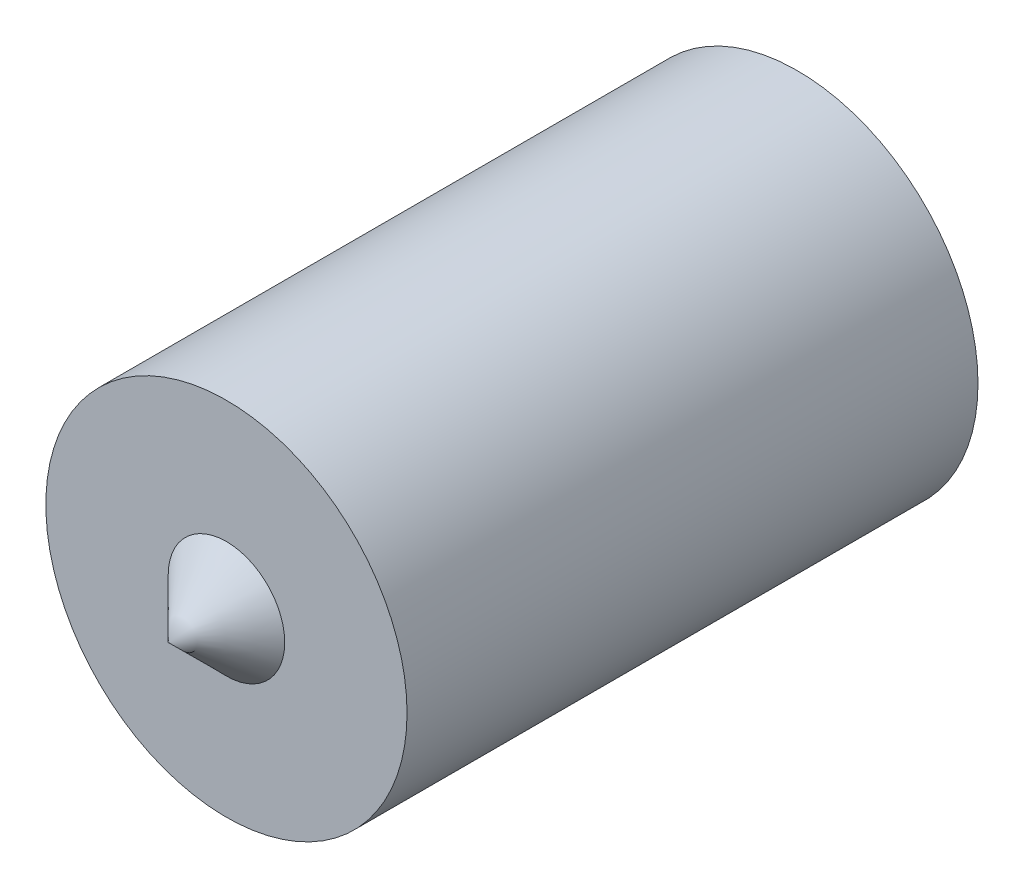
SolidWorks part; units mm, degrees
ref_plane "Спереди" through (0, 0, 0) normal (0, 0, 1) x (1, 0, 0)
ref_plane "Сверху" through (0, 0, 0) normal (0, 1, 0) x (1, 0, 0)
ref_plane "Справа" through (0, 0, 0) normal (1, 0, 0) x (0, 0, -1)
sketch "Эскиз1" plane through (0, 0, 0) normal (1, 0, 0) x (0, 0, -1)
  line L0 (0, 0) -> (32.7762, 0) construction
  line L1 (0, 0) -> (1.1155, 0)
  line L2 (1.1155, 0) -> (2.032, 1.5875)
  line L3 (2.032, 1.5875) -> (6.858, 1.5875)
  line L4 (6.858, 1.5875) -> (6.858, 1.9685)
  line L5 (6.858, 1.9685) -> (0.635, 1.9685)
  line L6 (0.635, 1.9685) -> (0.635, 0.635)
  line L7 (0.635, 0.635) -> (0, 0)
  dimension "D1" = 45
  dimension "D2" = 60
  dimension "D3" = 3.175
  dimension "D4" = 3.937
  dimension "D5" = 6.858
  dimension "D6" = 6.223
  dimension "D7" = 4.826
revolve "Повернуть1" add sketch "Эскиз1" angle 360 about L0
